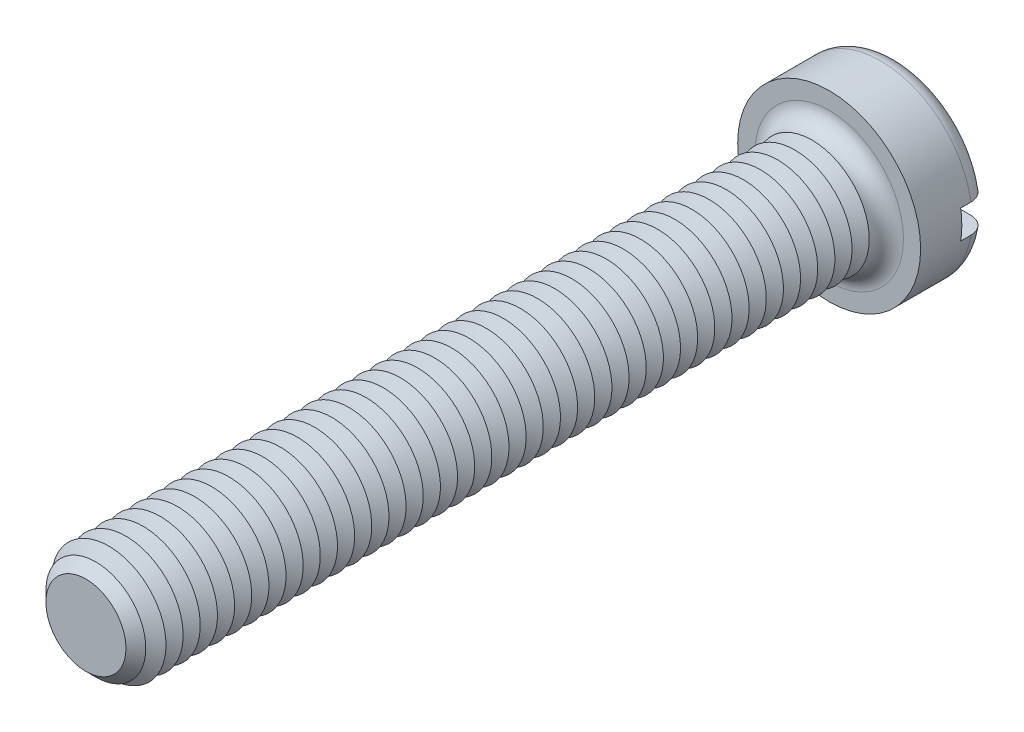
SolidWorks part; units mm, degrees
ref_plane "Front Plane" through (0, 0, 0) normal (0, 0, 1) x (1, 0, 0)
ref_plane "Top Plane" through (0, 0, 0) normal (0, 1, 0) x (1, 0, 0)
ref_plane "Right Plane" through (0, 0, 0) normal (1, 0, 0) x (0, 0, -1)
sketch "Sketch3" plane through (0, 0, 0) normal (0, 0, 1) x (1, 0, 0)
  circle A0 centre (0, 0) radius 8
  dimension "D1" = 16
extrude "Boss-Extrude2" add sketch "Sketch3" against normal blind 6
sketch "Sketch4" plane through (0, 0, 0) normal (0, 0, 1) x (1, 0, 0)
  circle A0 centre (0, 0) radius 5
  dimension "D1" = 10
extrude "Boss-Extrude3" add sketch "Sketch4" along normal blind 65
fillet "Fillet1" radius 1.5 2 edges at (8, 0, -6) (5, 0, 0)
chamfer "Chamfer1" distance 1.5 angle 45 1 edges at (5, 0, 65)
sketch "Sketch5" plane through (0, 0, 0) normal (1, 0, 0) x (0, 0, -1)
  line L0 (1.6944, 0) -> (-7.6738, 0) construction
sketch "Sketch6" plane through (0, 0, 0) normal (1, 0, 0) x (0, 0, -1)
  line L0 (-1.5, 5) -> (-2.25, 3.701)
  line L1 (-2.25, 3.701) -> (-3, 5)
  line L2 (-1.5, 5) -> (-63.5, 5) construction
  line L3 (-3, 5) -> (-1.5, 5)
  dimension "D1" = 1.5
revolve "Cut-Revolve1" cut sketch "Sketch6" angle 360 about L0
pattern_linear "LPattern1" count 42 spacing 1.5 along (0, 0, 1) of "Cut-Revolve1"
sketch "Sketch8" plane through (0, 0, -6) normal (0, 0, -1) x (-1, 0, 0)
  line L1 (8, -1.25) -> (-8, -1.25)
  line L2 (8, -1.25) -> (8, 1.25)
  line L3 (8, 1.25) -> (-8, 1.25)
  line L4 (-8, -1.25) -> (-8, 1.25)
  line L5 (8, -1.25) -> (-8, 1.25) construction
  line L6 (8, 1.25) -> (-8, -1.25) construction
  point P0 (0, 0)
  dimension "D1" = 16
  dimension "D2" = 2.5
extrude "Cut-Extrude1" cut sketch "Sketch8" against normal blind 2.4
